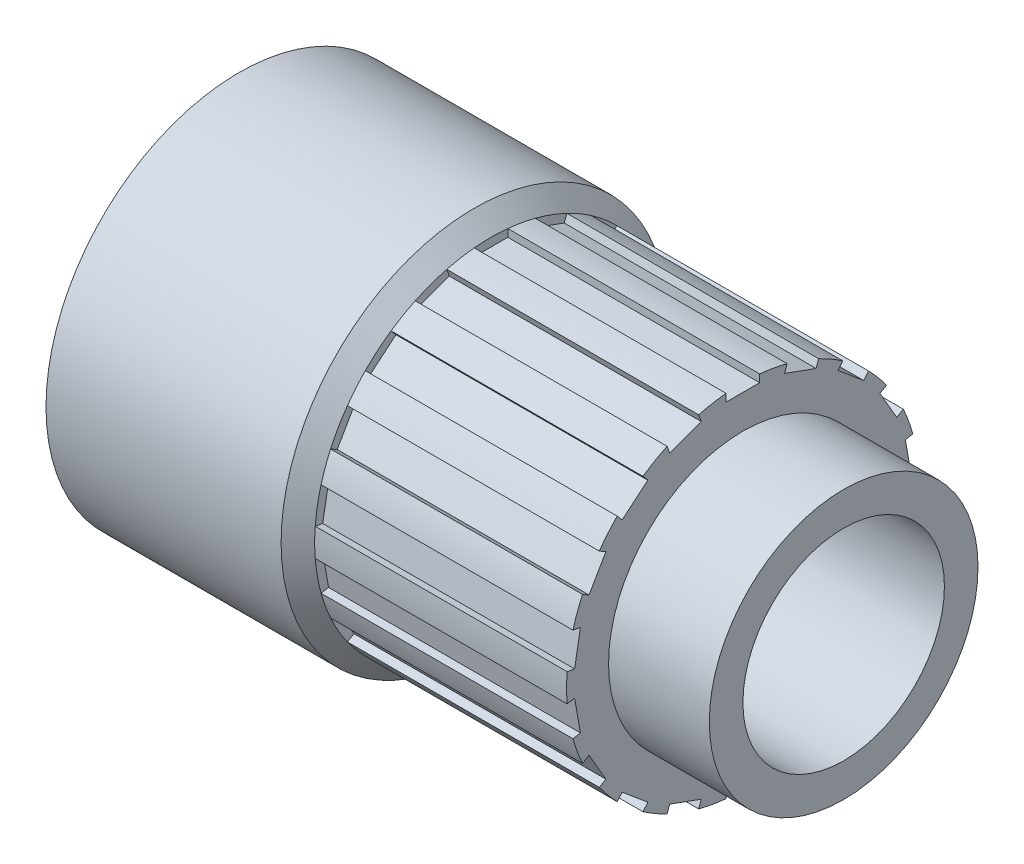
SolidWorks part; units mm, degrees
ref_plane "Plane1" through (0, 0, 0) normal (0, 0, 1) x (1, 0, 0)
ref_plane "Plane2" through (0, 0, 0) normal (0, 1, 0) x (1, 0, 0)
ref_plane "Plane3" through (0, 0, 0) normal (1, 0, 0) x (0, 0, -1)
sketch "Esquisse1" plane through (0, 0, 0) normal (0, 0, 1) x (1, 0, 0)
  line L0 (0, 4.5) -> (0, 5.75)
  line L1 (0, 5.75) -> (7, 5.75)
  line L2 (7, 5.75) -> (7.5, 5.25)
  line L3 (7.5, 5.25) -> (15, 5.25)
  line L4 (15, 5.25) -> (15, 4.5)
  line L6 (18, 4) -> (18, 3)
  line L7 (18, 3) -> (5.0047, 3)
  line L8 (0, 4.5) -> (5.0047, 4.5)
  line L9 (5.0047, 4.5) -> (5.0047, 3)
  line L10 (-3.5, 0) -> (24, 0) construction
  line L12 (15, 4) -> (15, 4.5)
  line L13 (18, 4) -> (15, 4)
  dimension "D2" = 7
  dimension "D3" = 0.75
  dimension "D5" = 4.5
  dimension "D6" = 4
revolve "Base-Révolution" add sketch "Esquisse1" angle 360 about L10
sketch "Esquisse3" plane through (15, 0, 0) normal (1, 0, 0) x (0, 0, -1)
  line L0 (-0.5, 5.5) -> (-0.5, 5)
  line L1 (-0.5, 5) -> (0.5, 5)
  line L2 (0.5, 5) -> (0.5, 5.5)
  line L3 (0.5, 5.5) -> (-0.5, 5.5)
extrude "Enlèv. mat.-Extru.1" cut sketch "Esquisse3" against normal blind 7.5
pattern_circular "Répétition circulaire1" count 18 every 20 about axis through (-3.5, 0, 0) along (1, 0, 0)
